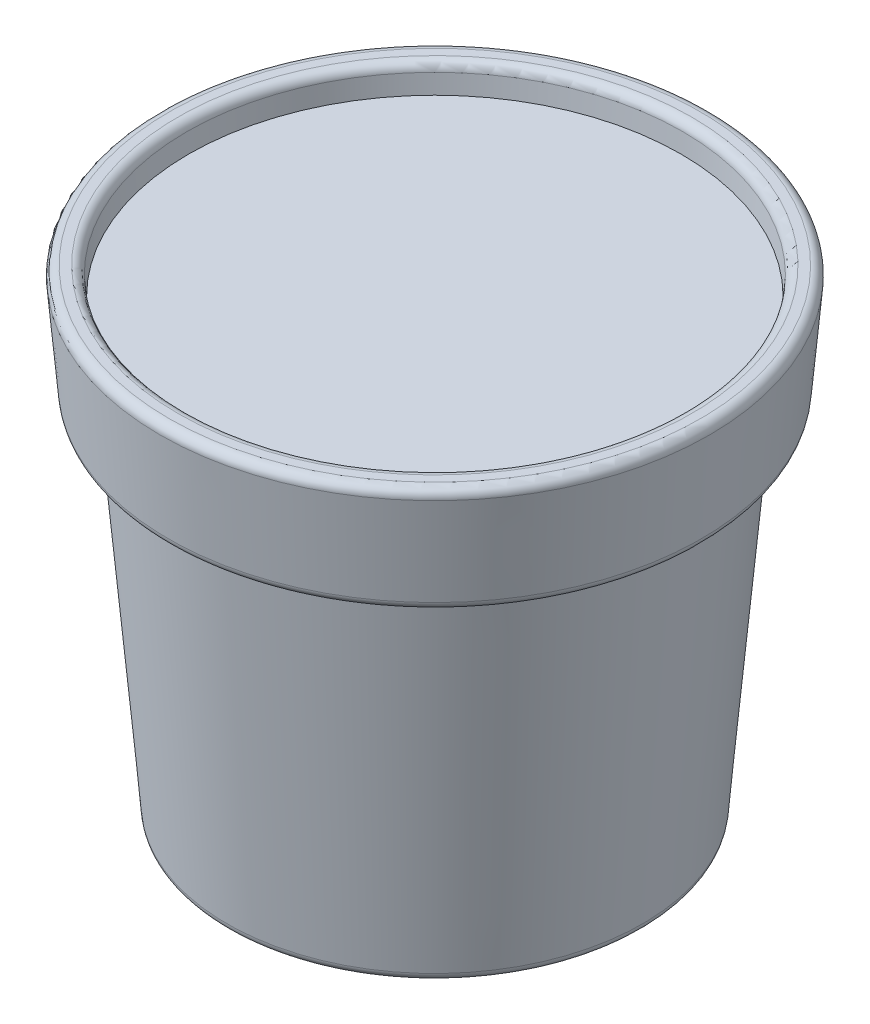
SolidWorks part; units mm, degrees
ref_plane "Front Plane" through (0, 0, 0) normal (0, 0, 1) x (1, 0, 0)
ref_plane "Top Plane" through (0, 0, 0) normal (0, 1, 0) x (1, 0, 0)
ref_plane "Right Plane" through (0, 0, 0) normal (1, 0, 0) x (0, 0, -1)
sketch "Sketch1" plane through (0, 0, 0) normal (0, 0, 1) x (1, 0, 0)
  line L0 (0, 0) -> (0, 100)
  line L1 (0, 100) -> (55, 100)
  line L2 (55, 100) -> (55.5249, 106)
  line L3 (55.5249, 106) -> (61.5249, 106)
  line L4 (61.5249, 106) -> (59.3377, 81)
  line L5 (59.3377, 81) -> (53.3377, 81)
  line L6 (53.3377, 81) -> (46.2511, 0)
  line L7 (46.2511, 0) -> (0, 0)
  dimension "D1" = 100
  dimension "D2" = 55
  dimension "D3" = 6
  dimension "D4" = 6
  dimension "D5" = 6
  dimension "D6" = 95
  dimension "D7" = 25
revolve "Revolve1" add sketch "Sketch1" angle 360 about L0
fillet "Fillet1" radius 2 4 edges at (0, 106, -61.5249) (0, 106, -55.5249) (0, 81, -59.3377) (0, 0, -46.2511)
